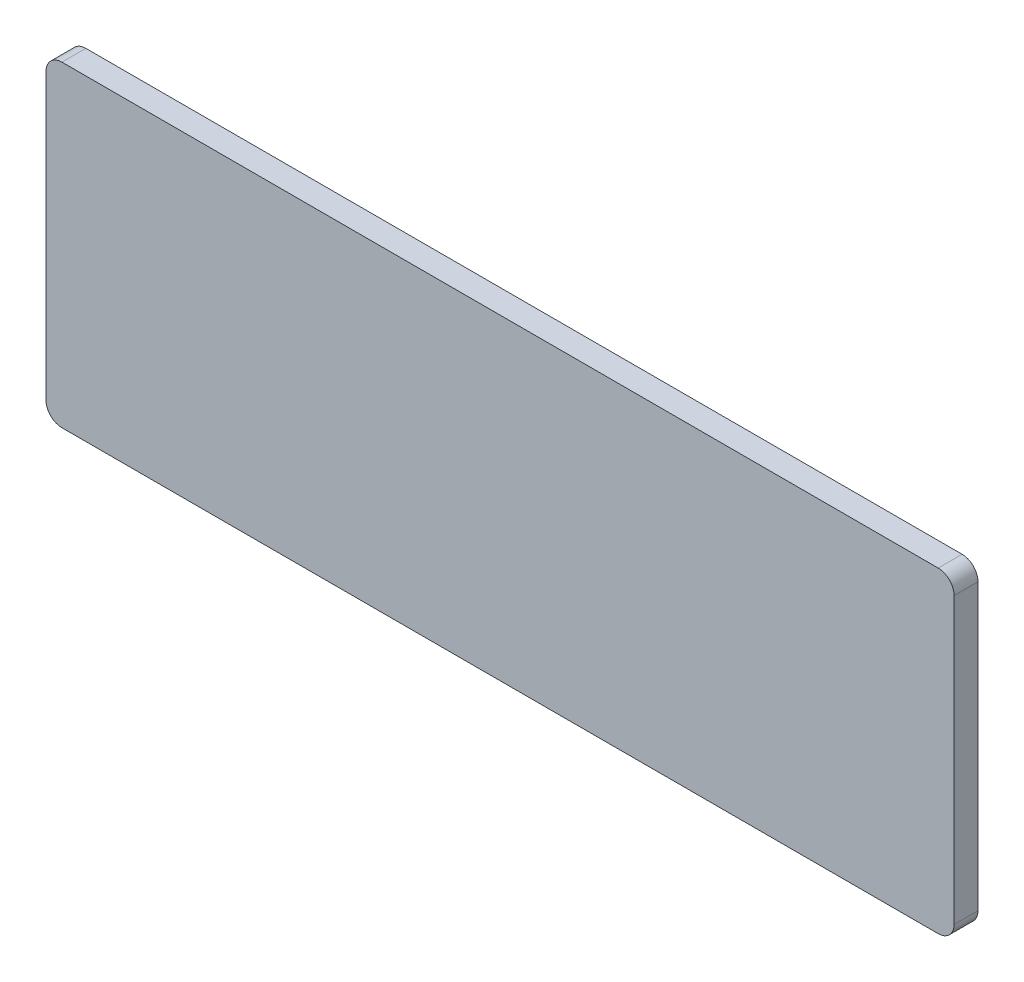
SolidWorks part; units mm, degrees
ref_plane "Front Plane" through (0, 0, 0) normal (0, 0, 1) x (1, 0, 0)
ref_plane "Top Plane" through (0, 0, 0) normal (0, 1, 0) x (1, 0, 0)
ref_plane "Right Plane" through (0, 0, 0) normal (1, 0, 0) x (0, 0, -1)
sketch "Sketch1" plane through (0, 0, 0) normal (0, 0, 1) x (1, 0, 0)
  line L0 (114, -40) -> (114, 0)
  line L6 (114, 0) -> (0, 0)
  line L7 (0, 0) -> (0, -40)
  line L8 (0, -40) -> (114, -40)
  dimension "D1" = 114
  dimension "D4" = 40
extrude "Boss-Extrude1" add sketch "Sketch1" along normal blind 3
sketch "Sketch2" plane through (0, 0, 3) normal (0, 0, 1) x (1, 0, 0)
  line L0 (114, -40) -> (114, 0) construction
  line L1 (0, -40) -> (114, -40)
  line L2 (0, -40) -> (0, -39.75)
  line L3 (0, -39.75) -> (114, -39.75)
  line L4 (114, -40) -> (114, -39.75)
  dimension "D1" = 0.25
extrude "Clearance" cut sketch "Sketch2" against normal through all
fillet "Fillet1" radius 2 4 edges at (114, -39.75, 1.5) (0, -39.75, 1.5) (0, 0, 1.5) (114, 0, 1.5)
